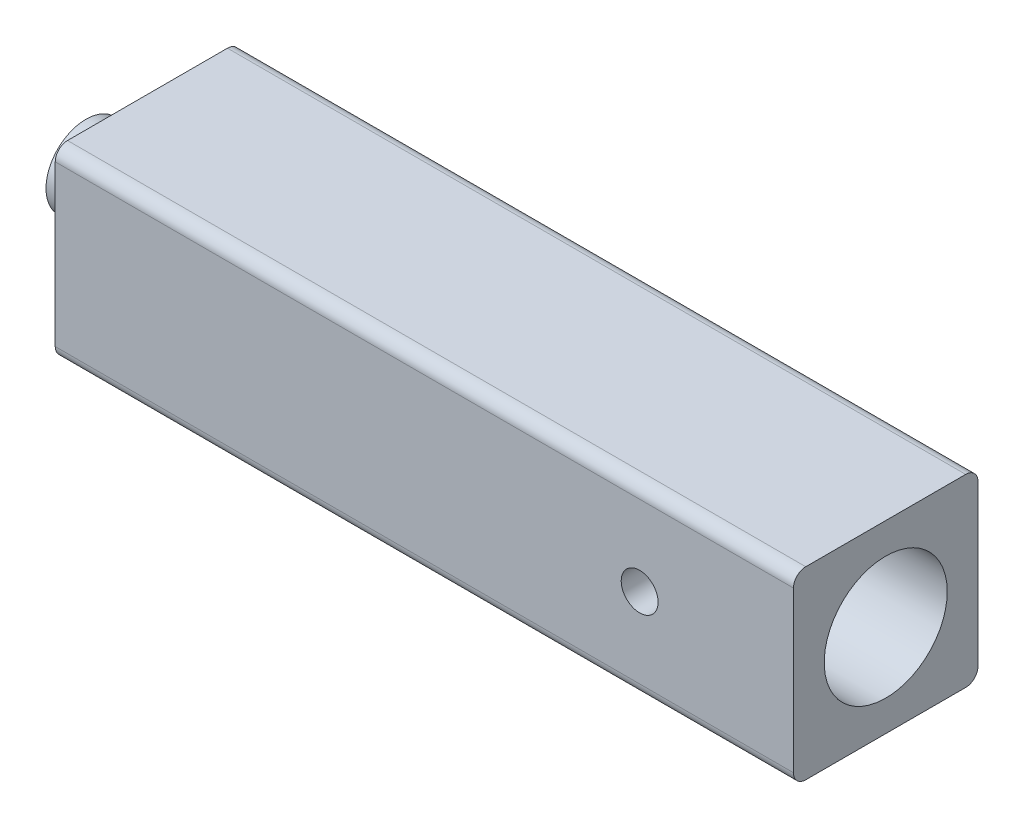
SolidWorks part; units mm, degrees
ref_plane "Front Plane" through (0, 0, 0) normal (0, 0, 1) x (1, 0, 0)
ref_plane "Top Plane" through (0, 0, 0) normal (0, 1, 0) x (1, 0, 0)
ref_plane "Right Plane" through (0, 0, 0) normal (1, 0, 0) x (0, 0, -1)
sketch "Sketch1" plane through (0, 0, 0) normal (1, 0, 0) x (0, 0, -1)
  line L1 (15, -15) -> (-15, -15)
  line L2 (15, -15) -> (15, 15)
  line L3 (15, 15) -> (-15, 15)
  line L4 (-15, -15) -> (-15, 15)
  line L5 (15, -15) -> (-15, 15) construction
  line L6 (15, 15) -> (-15, -15) construction
  point P0 (0, 0)
  dimension "D1" = 30
  dimension "D2" = 30
extrude "Boss-Extrude1" add sketch "Sketch1" along normal blind 120
sketch "Sketch2" plane through (120, 0, 0) normal (1, 0, 0) x (0, 0, -1)
  circle A0 centre (0, 0) radius 10
  dimension "D1" = 20
extrude "Cut-Extrude1" cut sketch "Sketch2" against normal blind 40
sketch "Sketch3" plane through (0, 0, 0) normal (0, 0, 1) x (1, 0, 0)
  line L0 (120, 15) -> (120, -15)
  line L1 (95, 15) -> (95, -15)
  circle A0 centre (95, 0) radius 3
  dimension "D2" = 6
  dimension "D1" = 25
extrude "Cut-Extrude2" cut sketch "Sketch3" against normal mid plane 40 contours L1 A0 | L1 A0
sketch "Sketch4" plane through (0, 0, 0) normal (-1, 0, 0) x (0, 0, 1)
  circle A0 centre (0, 0) radius 6.5
  dimension "D1" = 13
extrude "Boss-Extrude2" add sketch "Sketch4" along normal blind 10
fillet "Fillet1" radius 2 4 edges at (60, -15, 15) (60, -15, -15) (60, 15, -15) (60, 15, 15)
